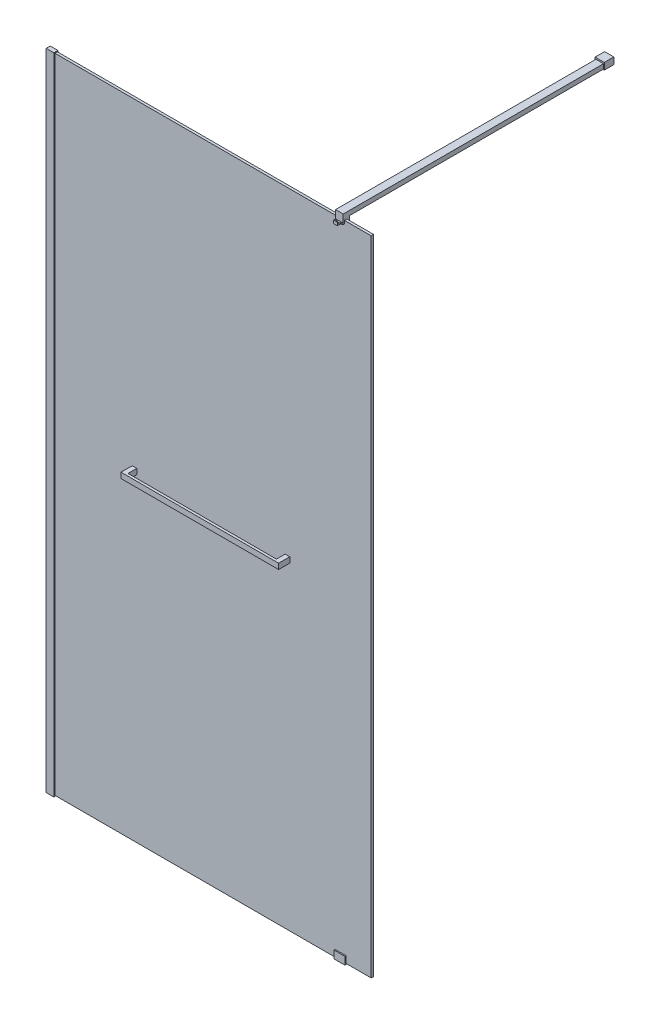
SolidWorks part; units mm, degrees
ref_plane "Płaszczyzna przednia" through (0, 0, 0) normal (0, 0, 1) x (1, 0, 0)
ref_plane "Płaszczyzna górna" through (0, 0, 0) normal (0, 1, 0) x (1, 0, 0)
ref_plane "Płaszczyzna prawa" through (0, 0, 0) normal (1, 0, 0) x (0, 0, -1)
sketch "Szkic1" plane through (0, 0, 0) normal (0, 1, 0) x (1, 0, 0)
  line L0 (0, 0) -> (0, 13.3)
  line L2 (0, 13.3) -> (25, 13.3)
  line L3 (25, 13.3) -> (25, 11.4)
  line L4 (25, 11.4) -> (11.45, 11.4)
  line L5 (11.45, 11.4) -> (11.45, 3.4)
  line L6 (11.45, 3.4) -> (25, 3.4)
  line L7 (25, 3.4) -> (25, 0)
  line L8 (25, 0) -> (0, 0)
  dimension "D1" = 13.3
  dimension "D4" = 1.9
  dimension "D5" = 8
  dimension "D6" = 3.4
  dimension "D7" = 13.55
  dimension "D8" = 25
extrude "Dodanie-wyciągnięcie1" add sketch "Szkic1" along normal blind 2100
sketch "Szkic2" plane through (0, 0, 0) normal (0, -1, 0) x (1, 0, 0)
  line L0 (11.45, -3.4) -> (1058.45, -3.4)
  line L1 (11.45, -3.4) -> (11.45, -11.4)
  line L2 (1058.45, -3.4) -> (1058.45, -11.4)
  line L3 (11.45, -11.4) -> (1058.45, -11.4)
  line L4 (11.45, -11.4) -> (25, -11.4) construction
  dimension "D1" = 1047
extrude "Dodanie-wyciągnięcie2" add sketch "Szkic2" against normal blind 2100 separate body
sketch "Szkic4" plane through (0, 2100, 0) normal (0, 1, 0) x (1, 0, 0)
  line L1 (25, 13.3) -> (0, 13.3) construction
  line L2 (25, 11.4) -> (25, 13.3) construction
  line L3 (0, 13.3) -> (0, 0) construction
  line L5 (0, 0) -> (25, 0) construction
  line L7 (25, 13.3) -> (0, 13.3)
  line L8 (25, 0) -> (25, 13.3)
  line L9 (0, 13.3) -> (0, 0)
  line L11 (0, 0) -> (25, 0)
extrude "Dodanie-wyciągnięcie3" add sketch "Szkic4" along normal blind 3
sketch "Szkic5" plane through (0, 0, 0) normal (0, -1, 0) x (1, 0, 0)
  line L1 (0, 0) -> (25, 0) construction
  line L2 (25, 0) -> (25, -3.4) construction
  line L3 (0, -13.3) -> (0, 0) construction
  line L5 (25, -13.3) -> (0, -13.3) construction
  line L7 (0, 0) -> (25, 0)
  line L8 (25, 0) -> (25, -13.3)
  line L9 (0, -13.3) -> (0, 0)
  line L11 (25, -13.3) -> (0, -13.3)
extrude "Dodanie-wyciągnięcie4" add sketch "Szkic5" along normal blind 3
ref_plane "Płaszczyzna1" through (958.45, 0, 0) normal (1, 0, 0) x (0, 0, -1)
sketch "Szkic6" plane through (958.45, 0, 0) normal (1, 0, 0) x (0, 0, -1)
  line L0 (11.4, 22) -> (15.75, 22)
  line L1 (15.75, 22) -> (15.75, -3)
  line L2 (15.75, -3) -> (-0.35, -3)
  line L3 (-0.35, -3) -> (-0.35, 22)
  line L4 (-0.35, 22) -> (3.4, 22)
  line L5 (11.4, 22) -> (11.4, 0)
  line L6 (11.4, 0) -> (11.4, 2100)
  line L7 (11.4, 0) -> (11.4, 2100) construction
  line L8 (3.4, 2100) -> (3.4, 0)
  line L9 (3.4, 2100) -> (3.4, 0) construction
  line L10 (11.4, 0) -> (3.4, 0)
  line L11 (3.4, 0) -> (3.4, 22)
  dimension "D1" = 4.35
  dimension "D2" = 25
  dimension "D3" = 3
  dimension "D4" = 3.75
extrude "Dodanie-wyciągnięcie5" add sketch "Szkic6" along normal mid plane 35 separate body
sketch "Szkic7" plane through (958.45, 0, 0) normal (1, 0, 0) x (0, 0, -1)
  line L0 (3.4, 2100) -> (3.4, 0) construction
  line L1 (-0.6, 2120) -> (19.4, 2120)
  line L2 (3.4, 2100) -> (3.4, 0) construction
  line L4 (11.4, 2100) -> (3.4, 2100) construction
  line L13 (11.4, 2100) -> (11.4, 0) construction
  line L20 (19.4, 2120) -> (19.4, 2090)
  line L25 (19.4, 2090) -> (11.4, 2090)
  line L26 (11.4, 2090) -> (11.4, 2100)
  line L27 (11.4, 2100) -> (3.4, 2100)
  line L28 (3.4, 2100) -> (3.4, 2090)
  line L29 (3.4, 2090) -> (-13.37, 2090)
  line L30 (-13.37, 2090) -> (-13.37, 2100)
  line L31 (-13.37, 2100) -> (-10.37, 2100)
  line L32 (-10.37, 2100) -> (-9.8451, 2094)
  line L33 (-9.8451, 2094) -> (-0.6, 2094)
  line L34 (-0.6, 2094) -> (-0.6, 2120)
  dimension "D3" = 20
  dimension "D4" = 30
  dimension "D5" = 16.77
  dimension "D6" = 4
  dimension "D14" = 8
  dimension "D21" = 10
  dimension "D22" = 4
  dimension "D23" = 3
  dimension "D24" = 95
extrude "Dodanie-wyciągnięcie6" add sketch "Szkic7" along normal mid plane 25 separate body
sketch "Szkic8" plane through (0, 2100, 0) normal (0, 1, 0) x (1, 0, 0)
  line L0 (945.95, -0.6) -> (952.45, -3.631)
  line L1 (952.45, -3.631) -> (952.45, -13.37)
  line L2 (970.95, -0.6) -> (964.45, -3.631)
  line L3 (964.45, -3.631) -> (964.45, -13.37)
  line L4 (958.45, -10.37) -> (958.45, 156.6902) construction
  line L5 (970.95, -10.37) -> (945.95, -10.37) construction
  line L6 (952.45, -13.37) -> (964.45, -13.37)
  line L7 (970.95, -13.37) -> (945.95, -13.37) construction
  dimension "D1" = 12
  dimension "D2" = 115
extrude "Wytnij-wyciągnięcie1" cut sketch "Szkic8" against normal through all and the other way through all
sketch "Szkic10" plane through (0, 2120, 0) normal (0, 1, 0) x (1, 0, 0)
  line L0 (958.45, 31.9) -> (958.45, 19.4) construction
  line L1 (945.95, 881.03) -> (970.95, 881.03)
  line L2 (945.95, 881.03) -> (945.95, 19.4)
  line L3 (945.95, 19.4) -> (970.95, 19.4)
  line L4 (970.95, 19.4) -> (945.95, 19.4) construction
  line L5 (945.95, 19.4) -> (945.95, -0.6) construction
  line L6 (970.95, 881.03) -> (970.95, 19.4)
  point P4 (958.45, 31.9)
  dimension "D2" = 861.63
  dimension "D1" = 25
  dimension "D3" = 12.5
extrude "Dodanie-wyciągnięcie7" add sketch "Szkic10" against normal blind 15
sketch "Szkic14" plane through (0, 0, -881.03) normal (0, 0, -1) x (-1, 0, 0)
  line L1 (-973.45, 2125) -> (-943.45, 2125)
  line L2 (-973.45, 2125) -> (-973.45, 2103)
  line L3 (-973.45, 2103) -> (-943.45, 2103)
  line L4 (-943.45, 2125) -> (-943.45, 2103)
  line L5 (-973.45, 2125) -> (-943.45, 2103) construction
  line L6 (-973.45, 2103) -> (-943.45, 2125) construction
  line L7 (-958.45, 2120) -> (-958.45, 2114) construction
  line L8 (-970.95, 2120) -> (-945.95, 2120) construction
  line L9 (-970.95, 2105) -> (-945.95, 2105) construction
  point P0 (-958.45, 2114)
  dimension "D1" = 30
  dimension "D2" = 22
  dimension "D3" = 2
extrude "Dodanie-wyciągnięcie8" add sketch "Szkic14" against normal blind 31
sketch "Szkic17" plane through (0, 0, -3.4) normal (0, 0, 1) x (1, 0, 0)
  line L0 (534.95, 2100) -> (534.95, 1050) construction
  line L1 (1058.45, 2100) -> (11.45, 2100) construction
  line L2 (534.95, 1050) -> (534.95, 0) construction
  line L3 (1058.45, 0) -> (11.45, 0) construction
  line L4 (284.95, 1050) -> (784.95, 1050) construction
  line L6 (277.45, 1059) -> (292.45, 1059)
  line L7 (277.45, 1059) -> (277.45, 1041)
  line L8 (277.45, 1041) -> (292.45, 1041)
  line L9 (292.45, 1059) -> (292.45, 1041)
  line L10 (277.45, 1059) -> (292.45, 1041) construction
  line L11 (277.45, 1041) -> (292.45, 1059) construction
  line L12 (777.45, 1059) -> (792.45, 1059)
  line L13 (777.45, 1059) -> (777.45, 1041)
  line L14 (777.45, 1041) -> (792.45, 1041)
  line L15 (792.45, 1059) -> (792.45, 1041)
  line L16 (777.45, 1059) -> (792.45, 1041) construction
  line L17 (777.45, 1041) -> (792.45, 1059) construction
  dimension "D1" = 500
  dimension "D2" = 15
  dimension "D3" = 18
extrude "polka_1a" add sketch "Szkic17" along normal blind 36.5 and the other way blind 31 separate body
sketch "Szkic18" plane through (277.45, 0, 0) normal (-1, 0, 0) x (0, 0, 1)
  line L0 (-34.4, 1059) -> (-34.4, 1041) construction
  line L1 (-34.4, 1053.73) -> (-21.6, 1053.73)
  line L2 (-34.4, 1053.73) -> (-34.4, 1045.73)
  line L3 (-34.4, 1045.73) -> (-21.6, 1045.73)
  line L4 (-21.6, 1053.73) -> (-21.6, 1045.73)
  line L5 (-34.4, 1041) -> (33.1, 1041) construction
  dimension "D1" = 4.73
  dimension "D2" = 8
  dimension "D3" = 12.8
extrude "polka_1b" cut sketch "Szkic18" against normal up to surface (515 mm away)
sketch "Szkic19" plane through (0, 1059, 0) normal (0, 1, 0) x (1, 0, 0)
  line L0 (792.45, 21.6) -> (277.45, 21.6)
  line L1 (792.45, 21.6) -> (792.45, 101.6)
  line L2 (277.45, 21.6) -> (277.45, 101.6)
  line L3 (792.45, 101.6) -> (277.45, 101.6)
  line L4 (792.45, 34.4) -> (792.45, -33.1) construction
  line L5 (277.45, 34.4) -> (277.45, -33.1) construction
  line L6 (11.45, 11.4) -> (1058.45, 11.4) construction
  dimension "D1" = 10.2
  dimension "D2" = 80
extrude "polka_1c" add sketch "Szkic19" against normal blind 8 from offset 5.28 separate body
sketch "Szkic20" plane through (292.45, 0, 0) normal (1, 0, 0) x (0, 0, -1)
  line L0 (34.4, 1041) -> (-33.1, 1041) construction
  line L1 (-33.1, 1059) -> (-25.1, 1059)
  line L2 (-33.1, 1059) -> (-33.1, 1041)
  line L3 (-33.1, 1041) -> (-25.1, 1041)
  line L4 (-25.1, 1059) -> (-25.1, 1041)
  dimension "D1" = 8
extrude "polka_1d" add sketch "Szkic20" along normal up to surface (485 mm away)
